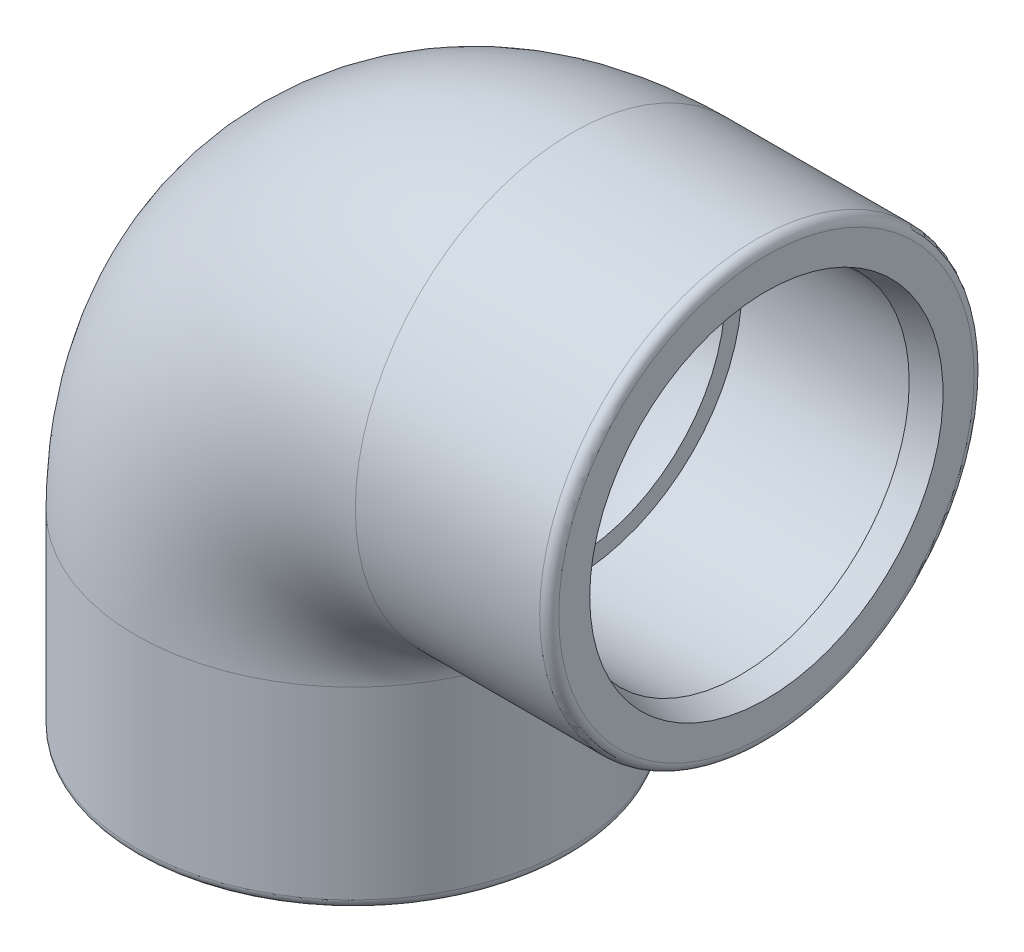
SolidWorks part; units mm, degrees
ref_plane "Front Plane" through (0, 0, 0) normal (0, 0, 1) x (1, 0, 0)
ref_plane "Top Plane" through (0, 0, 0) normal (0, 1, 0) x (1, 0, 0)
ref_plane "Right Plane" through (0, 0, 0) normal (1, 0, 0) x (0, 0, -1)
imported_body "Importée3"
sketch "Esquisse1" plane through (0, 0, 0) normal (0, -1, 0) x (1, 0, 0)
  circle A0 centre (-20.705, 0) radius 16
  circle A1 centre (-20.705, 0) radius 20.5
extrude "Boss.-Extru.1" add sketch "Esquisse1" along normal blind 18.295
chamfer "Chanfrein1" distance 0.675 angle 75 2 edges at (-20.705, -18.295, -16) (18.295, 20.705, 16)
fillet "Congé1" radius 0.9 2 edges at (18.295, 20.705, 20.5) (-20.705, -18.295, -20.5)
